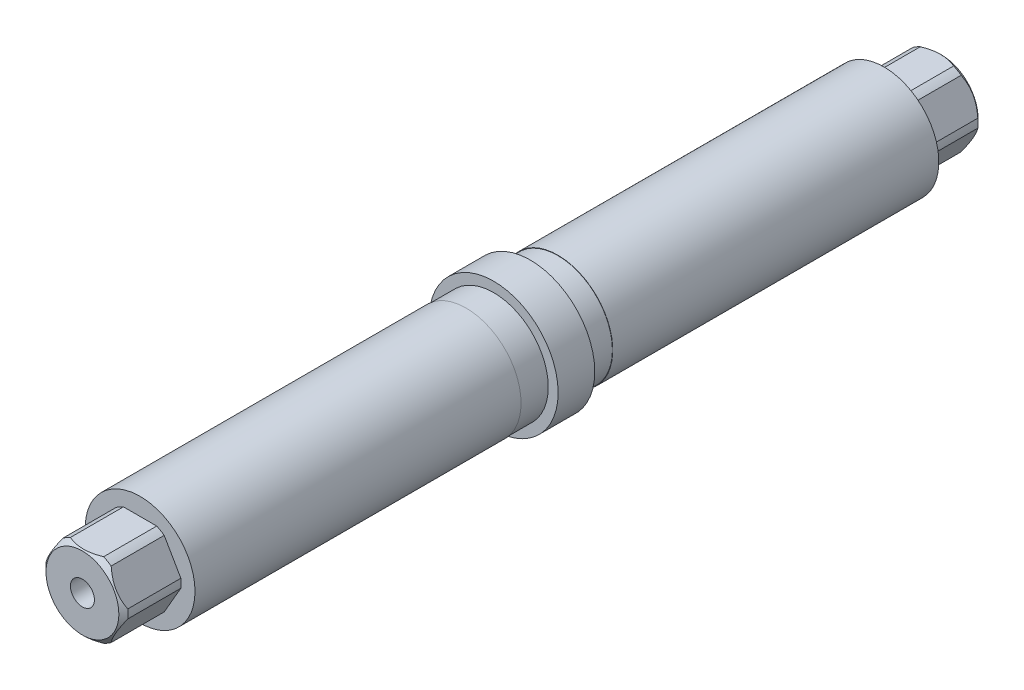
SolidWorks part; units mm, degrees
ref_plane "Front Plane" through (0, 0, 0) normal (0, 0, 1) x (1, 0, 0)
ref_plane "Top Plane" through (0, 0, 0) normal (0, 1, 0) x (1, 0, 0)
ref_plane "Right Plane" through (0, 0, 0) normal (1, 0, 0) x (0, 0, -1)
sketch "Sketch1" plane through (0, 0, 0) normal (0, 0, 1) x (1, 0, 0)
  circle A0 centre (0, 0) radius 11.176
  dimension "D1" = 22.352
extrude " CENTER BOSS" add sketch "Sketch1" along normal mid plane 6.35
sketch "Sketch11" plane through (0, 0, 3.175) normal (0, 0, 1) x (1, 0, 0)
  circle A0 centre (0, 0) radius 9.4615
extrude "SHOULDER RIGHT HAND THREAD" add sketch "Sketch11" along normal blind 4.7752
sketch "Sketch12" plane through (0, 0, -3.175) normal (0, 0, -1) x (-1, 0, 0)
  circle A0 centre (0, 0) radius 9.4615
extrude "SHOULDER LEFT HAND THREAD" add sketch "Sketch12" along normal blind 4.7752
sketch "Sketch2" plane through (0, 0, 7.9502) normal (0, 0, 1) x (1, 0, 0)
  circle A0 centre (0, 0) radius 9.525
  dimension "D1" = 19.05
extrude " RH THREAD" add sketch "Sketch2" along normal blind 56.5498
sketch "Sketch6" plane through (0, 0, -7.9502) normal (0, 0, -1) x (-1, 0, 0)
  circle A0 centre (0, 0) radius 9.525
  circle A1 centre (0, 0) radius 9.525 construction
extrude " LH THREAD" add sketch "Sketch6" along normal blind 56.5498
sketch "Sketch4" plane through (0, 0, 64.5) normal (0, 0, 1) x (1, 0, 0)
  line L1 (3.7528, 6.5) -> (-3.7528, 6.5)
  line L2 (-3.7528, 6.5) -> (-7.5056, 0)
  line L3 (-7.5056, 0) -> (-3.7528, -6.5)
  line L4 (-3.7528, -6.5) -> (3.7528, -6.5)
  line L5 (3.7528, -6.5) -> (7.5056, 0)
  line L6 (7.5056, 0) -> (3.7528, 6.5)
  circle A0 centre (0, 0) radius 6.5 construction
  dimension "D1" = 13
extrude " HEX BOSS" add sketch "Sketch4" along normal blind 10
sketch "Sketch5" plane through (0, 0, 74.5) normal (0, 0, 1) x (1, 0, 0)
  circle A0 centre (0, 0) radius 7.112
  circle A1 centre (0, 0) radius 11.176
  circle A4 centre (0, 0) radius 11.176 construction
  dimension "D1" = 14.224
extrude " ROUND ENDS" cut sketch "Sketch5" against normal blind 10
sketch "Sketch7" plane through (0, 0, 0) normal (-1, 0, 0) x (0, 1, 0)
  line L0 (0, 0) -> (0, -74.5) construction
  line L2 (-6.3182, -74.5) -> (-7.5882, -73.23)
  line L3 (5.7496, -74.5) -> (0.7504, -74.5) construction
  line L4 (-7.5882, -73.23) -> (-7.5882, -74.5)
  line L5 (-7.5882, -74.5) -> (-6.3182, -74.5)
  line L6 (-0.7504, -74.5) -> (-5.7496, -74.5) construction
  dimension "D1" = 12.6365
  dimension "D2" = 7.5883
revolve "Cut-Revolve1" cut sketch "Sketch7" angle 360 about L0
mirror "Mirror3" about plane through (0, 0, 0) normal (0, 0, 1) of "Cut-Revolve1", " ROUND ENDS", " HEX BOSS"
hole_wizard "#8-32 Tapped Hole1" positions "Sketch9" profile "Sketch10" tap size "#8-32" standard "ANSI Inch"
sketch "Sketch9" plane through (0, 0, 74.5) normal (0, 0, 1) x (1, 0, 0)
  point P0 (0, 0)
sketch "Sketch10" plane through (0, 0, 74.5) normal (1, 0, 0) x (0, -1, 0)
  line L0 (0, 0) -> (0, 13.3314)
  line L1 (0, 13.3314) -> (1.7272, 12.2936)
  line L2 (1.7272, 12.2936) -> (1.7272, 6.35)
  line L3 (1.7272, 6.35) -> (2.0828, 6.35)
  line L4 (2.0828, 6.35) -> (2.0828, 0)
  line L5 (2.0828, 0) -> (0, 0)
  line L10 (0, 13.3314) -> (-1.7272, 12.2936) construction
  line L11 (0, -6.35) -> (0, 107.95) construction
  dimension "Tap Drill Dia." = 3.4544
  dimension "Tap Drill Depth" = 12.2936
  dimension "Thread Major Dia." = 4.1656
  dimension "Thread Depth" = 6.35
  dimension "Drill Angle" = 118
fillet "Fillet1" [suppressed] radius 0.2032
equation "\"D1@ LH THREAD\"= \"D1@ RH THREAD\""
